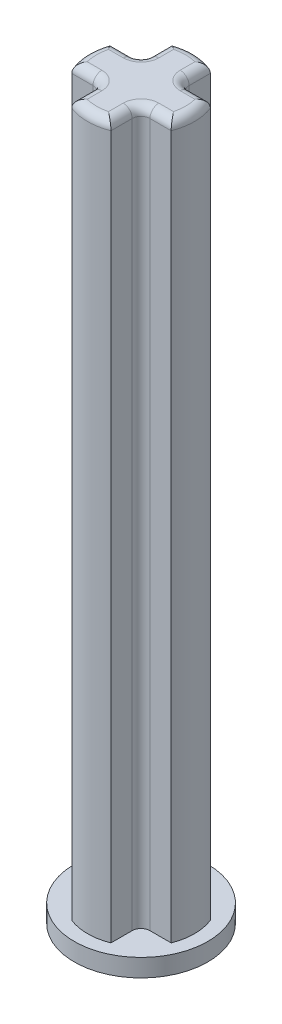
SolidWorks part; units mm, degrees
ref_plane "Front Plane" through (0, 0, 0) normal (0, 0, 1) x (1, 0, 0)
ref_plane "Top Plane" through (0, 0, 0) normal (0, 1, 0) x (1, 0, 0)
ref_plane "Right Plane" through (0, 0, 0) normal (1, 0, 0) x (0, 0, -1)
sketch "Sketch1" plane through (0, 0, 0) normal (0, 1, 0) x (1, 0, 0)
  line L8 (-2.2328, 0.88) -> (-0.88, 0.88)
  line L9 (2.2328, -0.88) -> (0.88, -0.88)
  line L10 (-0.88, 2.2328) -> (-0.88, 0.88)
  line L11 (-0.88, -0.88) -> (-0.88, -2.2328)
  line L12 (0.88, -2.2328) -> (0.88, -0.88)
  line L13 (0.88, 0.88) -> (2.2328, 0.88)
  line L14 (0.88, 0.88) -> (0.88, 2.2328)
  line L15 (-0.88, -0.88) -> (-2.2328, -0.88)
  arc A4 (2.2328, -0.88) -> (2.2328, 0.88) centre (0, 0) ccw
  arc A5 (0.88, 2.2328) -> (-0.88, 2.2328) centre (0, 0) ccw
  arc A6 (-2.2328, 0.88) -> (-2.2328, -0.88) centre (0, 0) ccw
  arc A7 (-0.88, -2.2328) -> (0.88, -2.2328) centre (0, 0) ccw
  dimension "D1" = 0.88
  dimension "D2" = 1.76
  dimension "D3" = 0.88
  dimension "D4" = 1.76
extrude "Boss-Extrude1" add sketch "Sketch1" along normal blind 32
fillet "Fillet7" radius 0.4 16 edges at (0, 32, -2.4) (0.88, 32, -1.5564) (1.5564, 32, -0.88) (2.4, 32, 0) (1.5564, 32, 0.88) (0.88, 32, 1.5564) (0, 32, 2.4) (-0.88, 32, 1.5564) (-1.5564, 32, 0.88) (-2.4, 32, 0) (-1.5564, 32, -0.88) (-0.88, 32, -1.5564) (-0.88, 16, -0.88) (0.88, 16, 0.88) (-0.88, 16, 0.88) (0.88, 16, -0.88)
sketch "Sketch2" plane through (0, 0, 0) normal (0, -1, 0) x (1, 0, 0)
  circle A0 centre (0, 0) radius 3
extrude "Boss-Extrude2" add sketch "Sketch2" along normal blind 0.8
